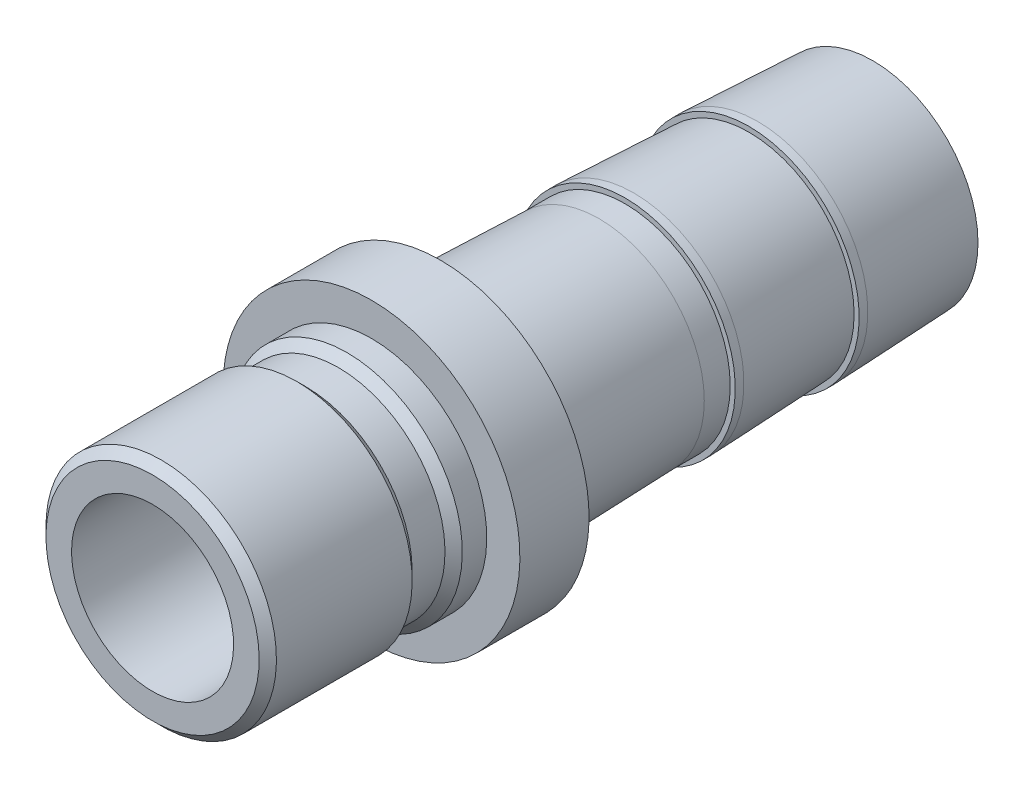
SolidWorks part; units mm, degrees
ref_plane "Front Plane" through (0, 0, 0) normal (0, 0, 1) x (1, 0, 0)
ref_plane "Top Plane" through (0, 0, 0) normal (0, 1, 0) x (1, 0, 0)
ref_plane "Right Plane" through (0, 0, 0) normal (1, 0, 0) x (0, 0, -1)
sketch "Sketch1" plane through (0, 0, 0) normal (1, 0, 0) x (0, 0, -1)
  line L0 (0, 0) -> (-22.479, 0) construction
  line L1 (-19.304, 7.1437) -> (-19.304, 9.398)
  line L2 (-5.8166, 9.398) -> (-5.8166, 0) construction
  line L3 (-18.542, 10.16) -> (-6.5786, 10.16)
  line L4 (0, 13.081) -> (0, 0) construction
  line L5 (-5.8166, 9.398) -> (-2.921, 9.398)
  line L6 (-2.159, 10.16) -> (0, 10.16)
  line L8 (-5.8166, 9.398) -> (-6.5786, 10.16)
  line L9 (-2.921, 9.398) -> (-2.159, 10.16)
  line L10 (-19.304, 9.398) -> (-18.542, 10.16)
  line L11 (-19.304, 7.1437) -> (44.196, 7.1437)
  line L13 (20.066, 9.271) -> (22.352, 9.271)
  line L14 (44.196, 9.271) -> (44.196, 7.1437)
  line L15 (43.2463, 0) -> (0, 0) construction
  line L18 (22.352, 9.271) -> (22.352, 9.7155)
  line L19 (22.352, 9.7155) -> (23.114, 9.7155)
  line L20 (23.114, 9.7155) -> (33.274, 9.271)
  line L21 (33.274, 9.271) -> (33.274, 9.7155)
  line L22 (33.274, 9.7155) -> (34.036, 9.7155)
  line L23 (34.036, 9.7155) -> (44.196, 9.271)
  line L24 (0, 10.16) -> (0, 13.081)
  line L25 (0, 13.081) -> (6.096, 13.081)
  line L26 (6.096, 13.081) -> (6.096, 9.7155)
  line L27 (6.096, 9.7155) -> (20.066, 9.271)
  point P12 (0, 0)
  point P17 (-19.0521, 7.112)
  point P21 (0, 10.557)
  dimension "D2" = 2.8956
  dimension "D3" = 0.762
  dimension "D4" = 45
  dimension "D5" = 13.4874
  dimension "D6" = 45
  dimension "D7" = 19.431
  dimension "D8" = 18.542
  dimension "D9" = 63.5
  dimension "D10" = 10.922
  dimension "D11" = 0.762
  dimension "D12" = 14.2875
  dimension "D13" = 2.286
  dimension "D14" = 20.32
  dimension "D18" = 26.162
  dimension "D19" = 38.1
  dimension "D20" = 19.304
revolve "Revolve1" add sketch "Sketch1" angle 360 about L0
